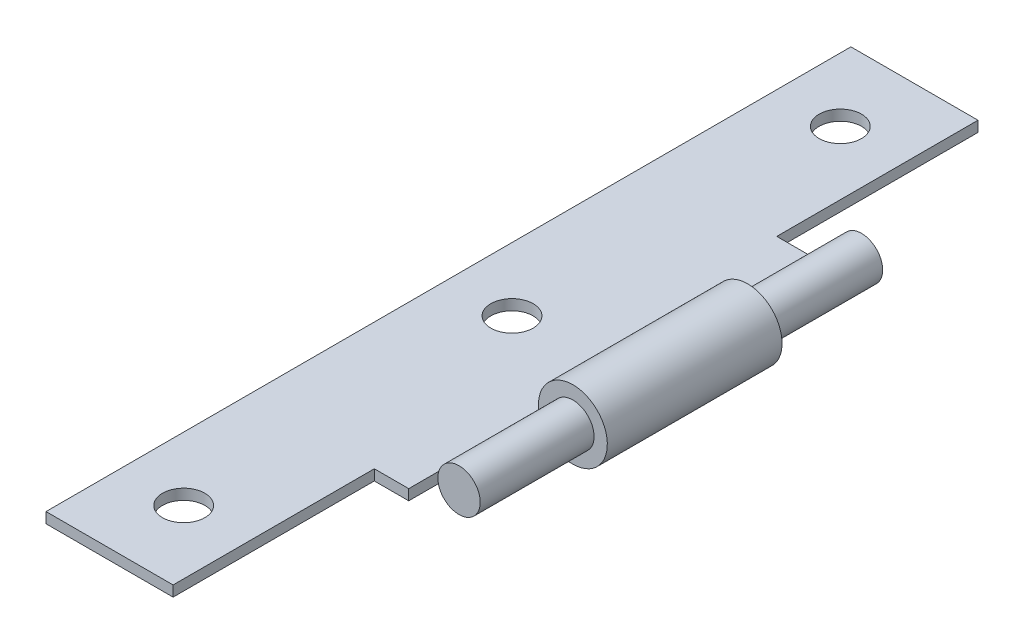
SolidWorks part; units mm, degrees
ref_plane "正面" through (0, 0, 0) normal (0, 0, 1) x (1, 0, 0)
ref_plane "平面" through (0, 0, 0) normal (0, 1, 0) x (1, 0, 0)
ref_plane "右側面" through (0, 0, 0) normal (1, 0, 0) x (0, 0, -1)
sketch "ｽｹｯﾁ1" plane through (0, 0, 0) normal (0, 0, 1) x (1, 0, 0)
  circle A0 centre (0, 0) radius 3.25
  dimension "D1" = 3.25
extrude "ﾎﾞｽ - 押し出し1" add sketch "ｽｹｯﾁ1" along normal mid plane 76
sketch "ｽｹｯﾁ2" plane through (0, 0, 0) normal (0, 0, 1) x (1, 0, 0)
  line L1 (-20, -2.25) -> (0, -2.25)
  line L2 (-20, -2.25) -> (-20, -3.25)
  line L3 (-20, -3.25) -> (0, -3.25)
  line L4 (0, -2.25) -> (0, -3.25)
  circle A0 centre (0, 0) radius 3.25 construction
  dimension "D1" = 20
  dimension "D2" = 1
extrude "ﾎﾞｽ - 押し出し2" add sketch "ｽｹｯﾁ2" along normal up to surface and the other way up to surface
sketch "ｽｹｯﾁ5" plane through (0, -3.25, 0) normal (0, -1, 0) x (1, 0, 0)
  line L0 (-2.3452, 38) -> (-20, 38) construction
  line L1 (-8, -38) -> (3.25, -38)
  line L2 (-8, -38) -> (-8, -19)
  line L4 (3.25, -38) -> (3.25, -8.25)
  line L5 (-4.75, -8.25) -> (3.25, -8.25)
  line L6 (-4.75, -8.25) -> (-4.75, -19)
  line L7 (-4.75, 8.25) -> (3.25, 8.25)
  line L8 (-4.75, -19) -> (-8, -19)
  line L9 (-8, 19) -> (-4.75, 19)
  line L10 (-8, 19) -> (-8, 38)
  line L11 (-8, 38) -> (3.25, 38)
  line L12 (3.25, 8.25) -> (3.25, 38)
  line L13 (-20, -38) -> (-2.3452, -38) construction
  line L15 (0, 0) -> (-4.75, 0) construction
  line L16 (-20, 38) -> (-20, -38) construction
  line L17 (-4.75, 8.25) -> (-4.75, 19)
  dimension "D1" = 16.5
  dimension "D2" = 3.25
  dimension "D3" = 12
  dimension "D4" = 15.25
  dimension "D5" = 38
extrude "ｶｯﾄ - 押し出し3" cut sketch "ｽｹｯﾁ5" against normal through all
sketch "ｽｹｯﾁ8" plane through (0, 0, 8.25) normal (0, 0, 1) x (1, 0, 0)
  circle A0 centre (0, 0) radius 2
  dimension "D1" = 4
extrude "ﾎﾞｽ - 押し出し3" add sketch "ｽｹｯﾁ8" along normal up to surface (10.75 mm away)
mirror "ﾐﾗｰ1" about plane through (0, 0, 0) normal (0, 0, 1) of "ﾎﾞｽ - 押し出し3"
hole_wizard "Ø4.0 (4) 直径の穴1" positions "ｽｹｯﾁ7" profile "ｽｹｯﾁ6" hole size "Ø4.0" standard "JIS"
sketch "ｽｹｯﾁ7" plane through (0, -2.25, 0) normal (0, 1, 0) x (-1, 0, 0)
  line L0 (20, 38) -> (20, -38) construction
  point P0 (14, -31)
  point P2 (14, 0)
  point P4 (14, 31)
  dimension "D1" = 31
  dimension "D2" = 31
  dimension "D3" = 6
sketch "ｽｹｯﾁ6" plane through (-14, -2.25, -31) normal (1, 0, 0) x (0, 0, 1)
  line L0 (0, 0) -> (0, 1)
  line L1 (0, 1) -> (2, 1)
  line L2 (2, 1) -> (2, 0)
  line L5 (2, 0) -> (0, 0)
  line L11 (0, -6.35) -> (0, 107.95) construction
  dimension "通し穴の直径" = 4
  dimension "通し穴の深さ" = 1
